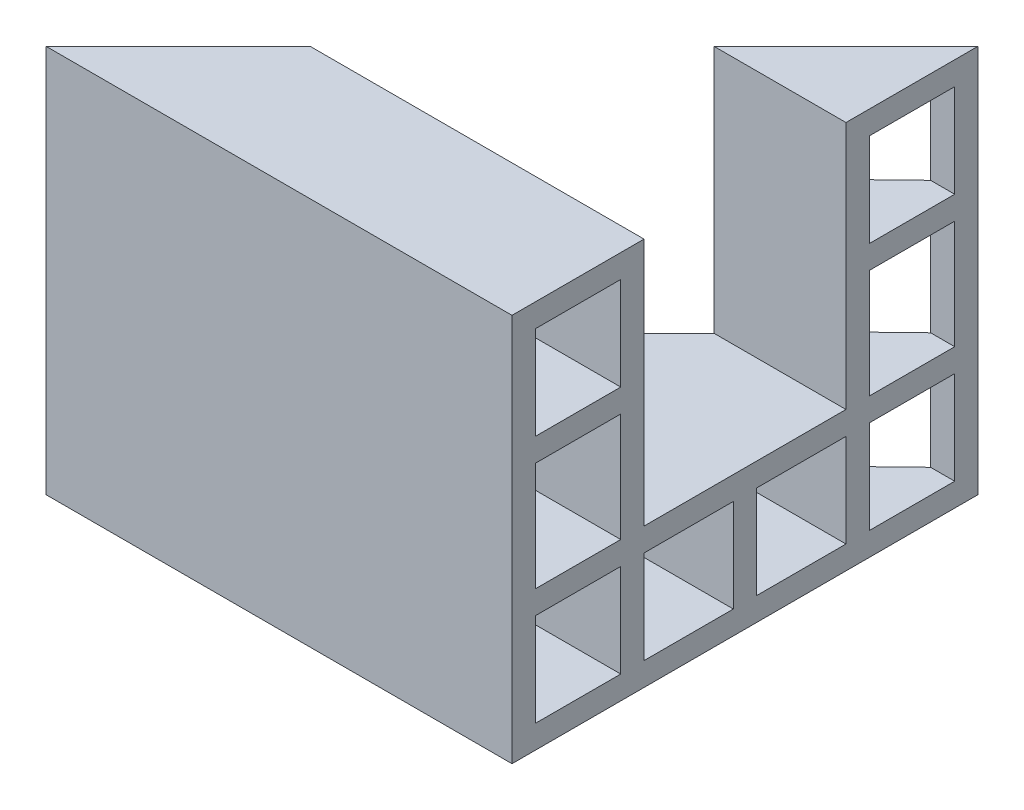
SolidWorks part; units mm, degrees
ref_plane "Face" through (0, 0, 0) normal (0, 0, 1) x (1, 0, 0)
ref_plane "Dessus" through (0, 0, 0) normal (0, 1, 0) x (1, 0, 0)
ref_plane "Droite" through (0, 0, 0) normal (1, 0, 0) x (0, 0, -1)
sketch "Esquisse1" plane through (0, 0, 0) normal (1, 0, 0) x (0, 0, -1)
  line L0 (-6.3934, 0) -> (65.9739, 0) construction
  line L1 (0, -8.3606) -> (0, 56.0651) construction
  line L2 (-6.3934, 25) -> (65.9739, 25) construction
  line L3 (30, -8.3606) -> (30, 56.0651) construction
  line L4 (15, 50.677) -> (15, -8.3606) construction
  line L5 (1.5, 31.0798) -> (1.5, -8.3606) construction
  line L6 (7, 31.0798) -> (7, -8.3606) construction
  line L7 (8.5, 31.0798) -> (8.5, -8.3606) construction
  line L8 (-1.3914, 12.5) -> (59.6308, 12.5) construction
  line L9 (-6.3934, 1.5) -> (31.1461, 1.5) construction
  line L10 (-6.3934, 7.5) -> (33.9897, 7.5) construction
  line L11 (-6.3934, 9) -> (33.9897, 9) construction
  line L12 (8.5, 9) -> (8.5, 25)
  line L13 (14.25, -8.3606) -> (14.25, 10.7738) construction
  line L14 (1.5, 16) -> (7, 16)
  line L15 (1.5, 7.5) -> (7, 7.5)
  line L16 (1.5, 7.5) -> (1.5, 1.5)
  line L17 (1.5, 1.5) -> (7, 1.5)
  line L18 (7, 7.5) -> (7, 1.5)
  line L19 (7, 17.5) -> (7, 23.5)
  line L20 (1.5, 16) -> (1.5, 9)
  line L21 (1.5, 9) -> (7, 9)
  line L22 (7, 16) -> (7, 9)
  line L23 (1.5, 23.5) -> (7, 23.5)
  line L24 (1.5, 17.5) -> (1.5, 23.5)
  line L25 (1.5, 17.5) -> (7, 17.5)
  line L26 (8.5, 7.5) -> (14.25, 7.5)
  line L27 (8.5, 7.5) -> (8.5, 1.5)
  line L28 (8.5, 1.5) -> (14.25, 1.5)
  line L29 (14.25, 7.5) -> (14.25, 1.5)
  line L30 (8.5, 25) -> (0, 25)
  line L31 (0, 25) -> (0, 0)
  line L32 (21.5, 25) -> (30, 25)
  line L33 (21.5, 9) -> (21.5, 25)
  line L34 (30, 25) -> (30, 0)
  line L35 (15.75, 7.5) -> (15.75, 1.5)
  line L36 (21.5, 1.5) -> (15.75, 1.5)
  line L37 (21.5, 7.5) -> (21.5, 1.5)
  line L38 (21.5, 7.5) -> (15.75, 7.5)
  line L39 (28.5, 17.5) -> (23, 17.5)
  line L40 (28.5, 17.5) -> (28.5, 23.5)
  line L41 (28.5, 23.5) -> (23, 23.5)
  line L42 (23, 16) -> (23, 9)
  line L43 (28.5, 9) -> (23, 9)
  line L44 (28.5, 16) -> (28.5, 9)
  line L45 (23, 17.5) -> (23, 23.5)
  line L46 (23, 7.5) -> (23, 1.5)
  line L47 (28.5, 1.5) -> (23, 1.5)
  line L48 (28.5, 7.5) -> (28.5, 1.5)
  line L49 (28.5, 7.5) -> (23, 7.5)
  line L50 (28.5, 16) -> (23, 16)
  line L51 (8.5, 9) -> (21.5, 9)
  line L52 (0, 0) -> (30, 0)
  dimension "D1" = 30
  dimension "D2" = 25
  dimension "D3" = 15
  dimension "D4" = 12.5
  dimension "D5" = 1.5
  dimension "D6" = 1.5
  dimension "D7" = 1.5
  dimension "D9" = 1.5
  dimension "D10" = 6
  dimension "D11" = 5.5
  dimension "D12" = 0.75
extrude "Extrusion1" add sketch "Esquisse1" along normal blind 30
draft "Dépouille1" type of draft neutral plane draft angle 1 faces to draft 32 parameters "D1"=1
sketch "Esquisse2" plane through (0, 25, 0) normal (0, 1, 0) x (-1, 0, 0)
  line L0 (-31.7335, -31.7335) -> (1.2689, -31.7335)
  line L1 (1.2689, 1.2689) -> (-31.7335, -31.7335)
  line L2 (1.2689, -31.7335) -> (1.2689, 1.2689)
extrude "Enlèv. mat.-Extru.1" cut sketch "Esquisse2" against normal through all
